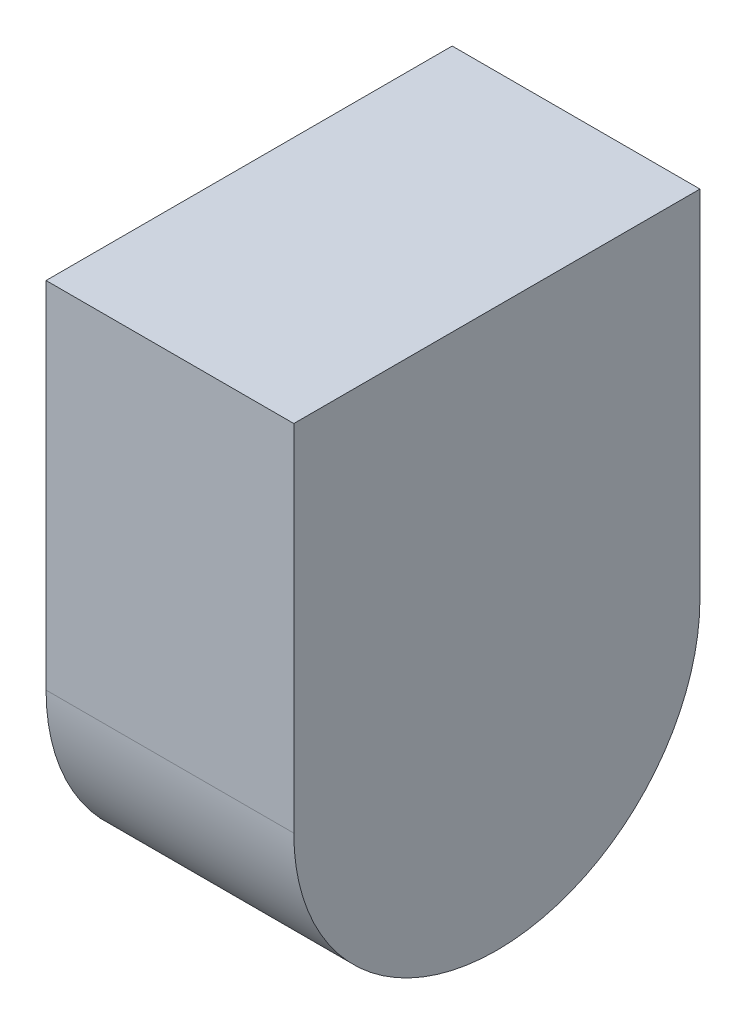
SolidWorks part; units mm, degrees
ref_plane "前视基准面" through (0, 0, 0) normal (0, 0, 1) x (1, 0, 0)
ref_plane "上视基准面" through (0, 0, 0) normal (0, 1, 0) x (1, 0, 0)
ref_plane "右视基准面" through (0, 0, 0) normal (1, 0, 0) x (0, 0, -1)
sketch "草图1" plane through (0, 0, 0) normal (1, 0, 0) x (0, 0, -1)
  line L0 (15, 0) -> (15, 26.2)
  line L1 (15, 26.2) -> (-15, 26.2)
  line L2 (-15, 26.2) -> (-15, 0)
  arc A0 (-15, 0) -> (15, 0) centre (0, 0) ccw
  dimension "D1" = 30
  dimension "D2" = 26.2
extrude "凸台-拉伸1" add sketch "草图1" along normal blind 1
sketch "草图2" plane through (1, 0, 0) normal (1, 0, 0) x (0, 0, -1)
  line L3 (15, 0) -> (15, 26.2)
  line L4 (15, 26.2) -> (-15, 26.2)
  line L5 (-15, 26.2) -> (-15, 0)
  line L6 (15, 0) -> (15, 26.2)
  line L7 (15, 26.2) -> (-15, 26.2)
  line L8 (-15, 26.2) -> (-15, 0)
  line L12 (14, 0) -> (14, 25.2)
  line L13 (14, 25.2) -> (-14, 25.2)
  line L14 (-14, 25.2) -> (-14, 0)
  line L15 (14, 0) -> (14, 25.2)
  line L16 (14, 25.2) -> (-14, 25.2)
  line L17 (-14, 25.2) -> (-14, 0)
  arc A1 (-15, 0) -> (15, 0) centre (0, 0) ccw
  arc A2 (-15, 0) -> (15, 0) centre (0, 0) ccw
  arc A4 (-14, 0) -> (14, 0) centre (0, 0) ccw
  arc A5 (-14, 0) -> (14, 0) centre (0, 0) ccw
  dimension "D1" = 0
  dimension "D2" = 1
extrude "凸台-拉伸2" add sketch "草图2" along normal blind 14.6
ref_plane "基准面1" through (3.6, 0, 0) normal (1, 0, 0) x (0, 0, -1)
sketch "草图4" plane through (3.6, 0, 0) normal (1, 0, 0) x (0, 0, -1)
  line L0 (14, 25.2) -> (14, 20.2)
  line L1 (14, 0) -> (14, 25.2) construction
  line L2 (14, 20.2) -> (-14, 20.2)
  line L3 (-14, 25.2) -> (-14, 0) construction
  line L4 (-14, 20.2) -> (-14, 14.2)
  line L5 (-14, 25.2) -> (-14, 0) construction
  line L6 (-14, 14.2) -> (-8.5, 8.7)
  line L7 (-8.5, 8.7) -> (8.5, 8.7)
  line L8 (8.5, 8.7) -> (14, 14.2)
  line L9 (14, 14.2) -> (14, 20.2)
  dimension "D1" = 5
  dimension "D2" = 6
  dimension "D3" = 6
  dimension "D4" = 11.5
extrude "凸台-拉伸3" add sketch "草图4" along normal blind 6 contours L8 L9 L2 L4 L6 L7
ref_plane "基准面2" through (14.6, 0, 0) normal (1, 0, 0) x (0, 0, -1)
sketch "草图5" plane through (14.6, 0, 0) normal (1, 0, 0) x (0, 0, -1)
  line L0 (14, 14.2) -> (14, 20.2)
  line L1 (14, 20.2) -> (-14, 20.2)
  line L2 (-14, 20.2) -> (-14, 14.2)
  line L3 (-14, 14.2) -> (-8.5, 8.7)
  line L4 (-8.5, 8.7) -> (8.5, 8.7)
  line L5 (8.5, 8.7) -> (14, 14.2)
extrude "凸台-拉伸4" add sketch "草图5" against normal blind 2.5
sketch "草图6" plane through (15.6, 0, 0) normal (1, 0, 0) x (0, 0, -1)
  line L1 (-15, 0) -> (-15, 26.2)
  line L3 (15, 0) -> (15, 26.2)
  line L4 (15, 26.2) -> (-15, 26.2)
  line L5 (-15, 26.2) -> (-15, 0)
  line L6 (15, 0) -> (15, 26.2)
  line L7 (15, 26.2) -> (-15, 26.2)
  arc A1 (-15, 0) -> (15, 0) centre (0, 0) ccw
  arc A2 (-15, 0) -> (15, 0) centre (0, 0) ccw
  dimension "D1" = 0
extrude "凸台-拉伸6" add sketch "草图6" along normal blind 2.7
